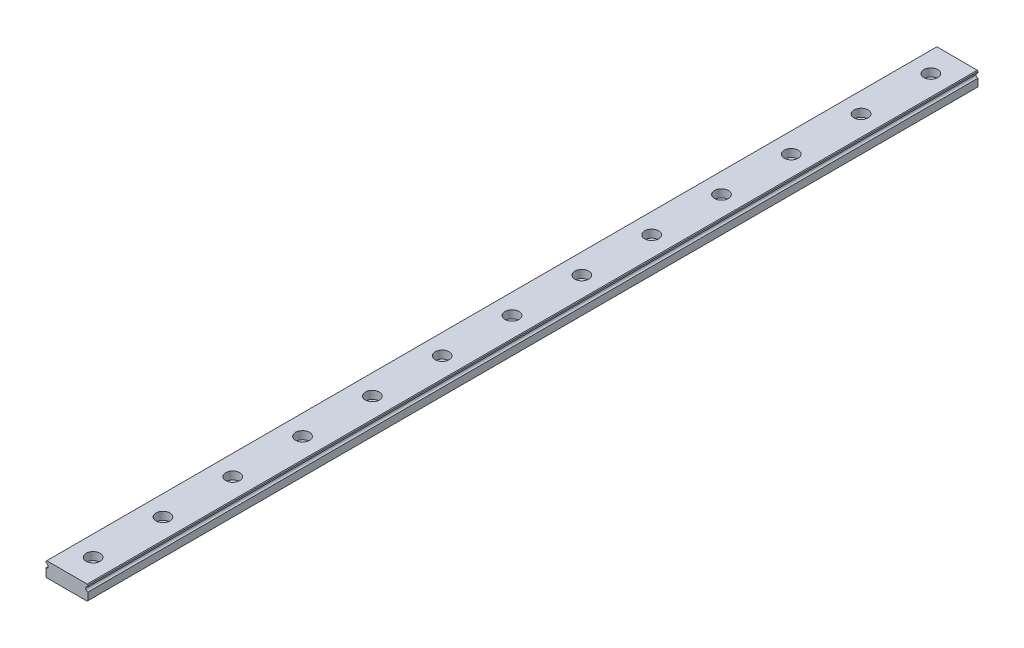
SolidWorks part; units mm, degrees
ref_plane "前视" through (0, 0, 0) normal (0, 0, 1) x (1, 0, 0)
ref_plane "上视" through (0, 0, 0) normal (0, 1, 0) x (1, 0, 0)
ref_plane "右视" through (0, 0, 0) normal (1, 0, 0) x (0, 0, -1)
sketch "草图1" plane through (0, 0, 0) normal (0, 0, 1) x (1, 0, 0)
  line L0 (0, 4.25) -> (0, -4.25) construction
  line L1 (-12, 3) -> (-12, 3.85)
  line L2 (-11.6, 4.25) -> (-12, 3.85)
  line L3 (11.6, 4.25) -> (-11.6, 4.25)
  line L4 (12, 3.85) -> (11.6, 4.25)
  line L5 (12, 3.85) -> (12, 3)
  line L6 (11.6, -4.25) -> (12, -3.85)
  line L7 (11.6, -4.25) -> (6.3, -4.25)
  line L8 (5.7, -4.25) -> (-11.6, -4.25)
  line L9 (-12, -3.85) -> (-11.6, -4.25)
  line L10 (-12, -3.85) -> (-12, 0.5)
  line L11 (12, 0.5) -> (12, -3.85)
  arc A0 (-12, 0.5) -> (-12, 3) centre (-12, 1.75) ccw
  arc A1 (12, 3) -> (12, 0.5) centre (12, 1.75) ccw
  arc A2 (6.3, -4.25) -> (5.7, -4.25) centre (6, -4.25) ccw
extrude "凸台-拉伸1" add sketch "草图1" against normal blind 510
hole_wizard "打孔尺寸根据内六角圆柱头螺钉的类型1" positions "草图3" profile "草图2" counterbore size "M4" standard "Gb"
sketch "草图3" plane through (0, 4.25, 0) normal (0, 1, 0) x (1, 0, 0)
  line L0 (0, 510) -> (0, 0) construction
  line L1 (11.6, 510) -> (-11.6, 510) construction
  line L2 (11.6, 0) -> (-11.6, 0) construction
  point P0 (0, 15)
  dimension "D1" = 15
sketch "草图2" plane through (0, 4.25, -15) normal (1, 0, 0) x (0, 0, 1)
  line L0 (0, 0) -> (0, 8.5)
  line L1 (0, 8.5) -> (2.25, 8.5)
  line L3 (2.25, 8.5) -> (2.25, 4.5)
  line L4 (2.25, 4.5) -> (4, 4.5)
  line L5 (4, 4.5) -> (4, 0)
  line L7 (4, 0) -> (0, 0)
  line L11 (0, -6.35) -> (0, 107.95) construction
  dimension "通孔孔直径" = 4.5
  dimension "通孔孔深度" = 8.5
  dimension "柱形沉头孔直径" = 8
  dimension "柱形沉头孔深度" = 4.5
pattern_linear "阵列(线性)1" count 13 spacing 40 along (0, 0, -1) of "打孔尺寸根据内六角圆柱头螺钉的类型1"
